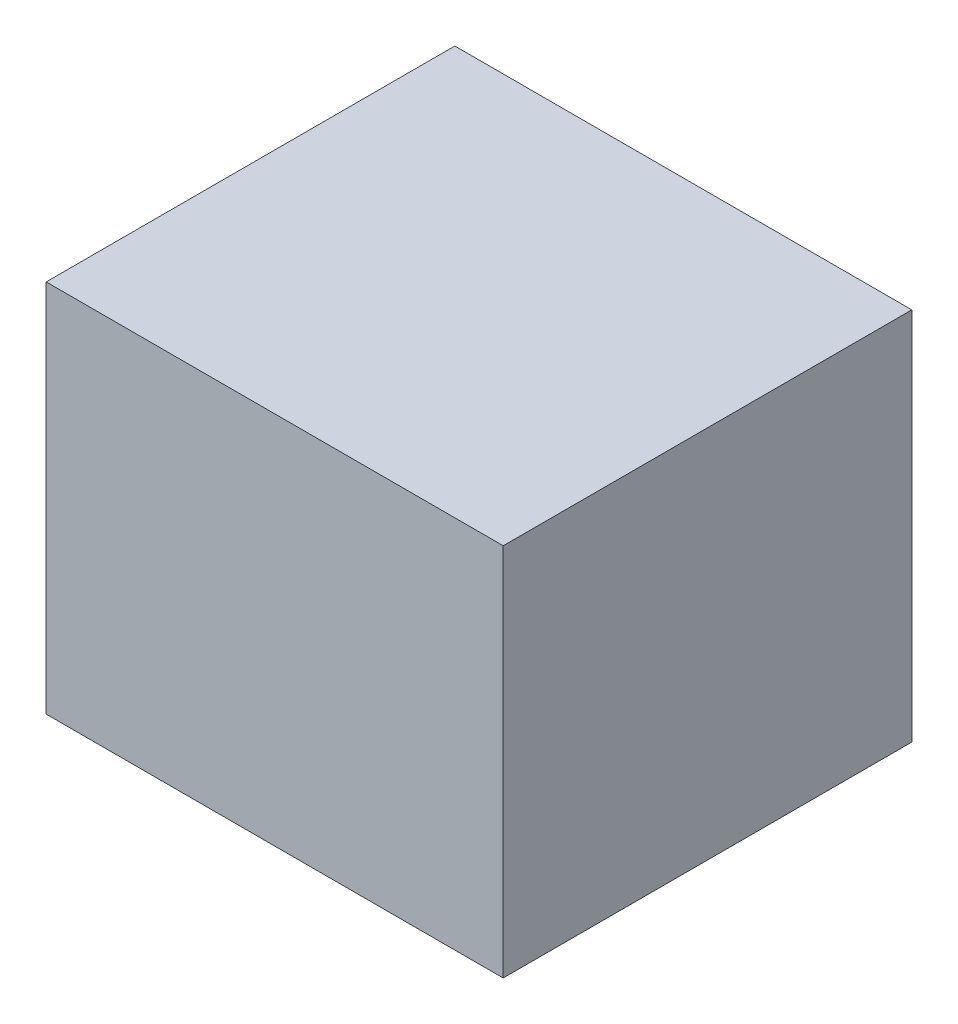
SolidWorks part; units mm, degrees
ref_plane "Front" through (0, 0, 0) normal (0, 0, 1) x (1, 0, 0)
ref_plane "Top" through (0, 0, 0) normal (0, 1, 0) x (1, 0, 0)
ref_plane "Right" through (0, 0, 0) normal (1, 0, 0) x (0, 0, -1)
sketch "Sketch1"
  dimension "D1" = 42.1439
  dimension "D2" = 51.4493
extrude "Extrude1" add sketch "Sketch1" along normal blind 46
